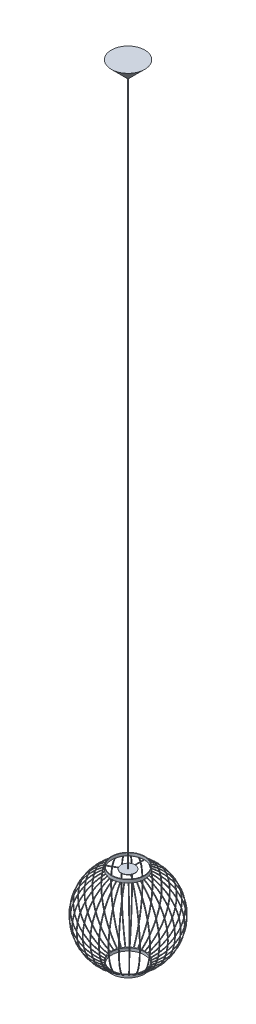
SolidWorks part; units mm, degrees
ref_plane "Alzado" through (0, 0, 0) normal (0, 0, 1) x (1, 0, 0)
ref_plane "Planta" through (0, 0, 0) normal (0, 1, 0) x (1, 0, 0)
ref_plane "Vista lateral" through (0, 0, 0) normal (1, 0, 0) x (0, 0, -1)
sketch "Croquis1" plane through (0, 0, 0) normal (0, 0, 1) x (1, 0, 0)
  line L0 (0, 0) -> (0, 2805) construction
  line L1 (-58, 0) -> (-60, 0)
  line L2 (0, 0) -> (0, 305) construction
  line L3 (0, 0) -> (0, 152.5) construction
  line L4 (0, 152.5) -> (-150, 152.5) construction
  line L5 (-58, 305.0698) -> (-60, 305)
  line L6 (-60, 0) -> (-60, 10)
  line L8 (0, 10) -> (0, 0)
  line L9 (0, 295) -> (0, 305)
  line L10 (-60, 305) -> (-60, 295)
  line L12 (0, 295) -> (0, 10)
  line L13 (-60, 305) -> (-58, 305.0698)
  line L14 (-58, 305.0698) -> (-58, 296)
  line L15 (-60, 0) -> (-59.5703, 0)
  line L16 (-58, 0) -> (-58, 10)
  line L17 (-58, 10) -> (-58, 10.1663)
  line L18 (-58, 294.8337) -> (0, 295)
  line L19 (0, 296) -> (-58, 296)
  line L20 (0, 296) -> (-1, 296)
  line L21 (0, 2805) -> (-60, 2805)
  line L22 (0, 2805) -> (0, 2745)
  line L23 (-1, 2746) -> (-60, 2805)
  line L24 (0, 305) -> (0, 2745)
  line L25 (-1, 296) -> (-1, 2746)
  arc A0 (-60, 295) -> (-60, 10) centre (7.8125, 152.5) ccw
  arc A1 (-58, 294.8337) -> (-58, 10.1663) centre (7.8125, 152.5) ccw
  dimension "D3" = 305
  dimension "D6" = 2
  dimension "D1" = 2805
  dimension "D2" = 150
  dimension "D4" = 10
  dimension "D5" = 60
  dimension "D7" = 10
  dimension "D8" = 10.2362
  dimension "D9" = 2
  dimension "D10" = 1
revolve "Revolución1" add sketch "Croquis1" angle 360 about L0
sketch "Croquis3" plane through (0, 296, 0) normal (0, 1, 0) x (1, 0, 0)
  line L0 (22.1333, -11.624) -> (50.7295, -28.134)
  line L1 (1, 24.98) -> (1, 58)
  line L2 (-1, 24.98) -> (-1, 58)
  line L3 (21.1333, -13.356) -> (49.7295, -29.866)
  line L4 (-21.1333, -13.356) -> (-49.7295, -29.866)
  line L5 (-22.1333, -11.624) -> (-50.7295, -28.134)
  arc A0 (-1, 24.98) -> (-22.1333, -11.624) centre (0, 0) ccw
  arc A1 (-1, 58) -> (-50.7295, -28.134) centre (0, 0) ccw
  arc A2 (-21.1333, -13.356) -> (21.1333, -13.356) centre (0, 0) ccw
  arc A3 (-49.7295, -29.866) -> (49.7295, -29.866) centre (0, 0) ccw
  arc A4 (22.1333, -11.624) -> (1, 24.98) centre (0, 0) ccw
  arc A5 (50.7295, -28.134) -> (1, 58) centre (0, 0) ccw
  point P16 (0, 0)
  dimension "D1" = 3
extrude "Cortar-Extruir1" cut sketch "Croquis3" against normal blind 10
sketch "Croquis5" plane through (0, 296, 0) normal (0, 1, 0) x (1, 0, 0)
  line L0 (11.6959, 58.849) -> (30.3621, 161.7084)
  line L1 (1, 59.9917) -> (1, 164.5311)
  line L2 (-1, 59.9917) -> (-1, 164.5311)
  line L3 (9.728, 59.2061) -> (28.3942, 162.0655)
  line L4 (22.0158, 55.8149) -> (58.7483, 153.6884)
  line L5 (20.1433, 56.5177) -> (56.8758, 154.3911)
  line L6 (31.6281, 50.9869) -> (85.2463, 140.7286)
  line L7 (29.9112, 52.0127) -> (83.5294, 141.7544)
  line L8 (40.2239, 44.5201) -> (109.0044, 123.2457)
  line L9 (38.7178, 45.836) -> (107.4983, 124.5616)
  line L10 (47.5269, 36.6224) -> (129.2591, 101.8016)
  line L11 (46.2799, 38.186) -> (128.0121, 103.3653)
  line L12 (53.3023, 27.5476) -> (145.3592, 77.0855)
  line L13 (52.3545, 29.3088) -> (144.4115, 78.8467)
  line L14 (57.3645, 17.5874) -> (156.7874, 49.8918)
  line L15 (56.7464, 19.4895) -> (156.1693, 51.794)
  line L16 (59.583, 7.0619) -> (163.1763, 21.0946)
  line L17 (59.3145, 9.0438) -> (162.9078, 23.0765)
  line L18 (59.8864, -3.6905) -> (164.3205, -8.3807)
  line L19 (59.9761, -1.6925) -> (164.4103, -6.3827)
  line L20 (58.265, -14.3243) -> (160.1834, -37.5865)
  line L21 (58.7101, -12.3745) -> (160.6285, -35.6367)
  line L22 (54.771, -24.4978) -> (150.8979, -65.5844)
  line L23 (55.557, -22.6587) -> (151.6839, -63.7453)
  line L24 (49.5165, -33.8838) -> (136.7623, -91.4742)
  line L25 (50.6183, -32.2147) -> (137.8641, -89.8051)
  line L26 (42.6706, -42.1808) -> (118.2312, -114.4241)
  line L27 (44.0527, -40.7352) -> (119.6133, -112.9785)
  line L28 (34.4532, -49.1221) -> (95.8999, -133.6962)
  line L29 (36.0712, -47.9465) -> (97.518, -132.5206)
  line L30 (25.1284, -54.4845) -> (70.4864, -148.6713)
  line L31 (26.9304, -53.6167) -> (72.2883, -147.8035)
  line L32 (14.996, -58.0958) -> (42.8074, -158.8679)
  line L33 (16.924, -57.5637) -> (44.7353, -158.3358)
  line L34 (4.3816, -59.8398) -> (13.7525, -163.9584)
  line L35 (6.3736, -59.6605) -> (15.7444, -163.7791)
  line L36 (-6.3736, -59.6605) -> (-15.7444, -163.7791)
  line L37 (-4.3816, -59.8398) -> (-13.7525, -163.9584)
  line L38 (-16.924, -57.5637) -> (-44.7353, -158.3358)
  line L39 (-14.996, -58.0958) -> (-42.8074, -158.8679)
  line L40 (-26.9304, -53.6167) -> (-72.2883, -147.8035)
  line L41 (-25.1284, -54.4845) -> (-70.4864, -148.6713)
  line L42 (-36.0712, -47.9465) -> (-97.518, -132.5206)
  line L43 (-34.4532, -49.1221) -> (-95.8999, -133.6962)
  line L44 (-44.0527, -40.7352) -> (-119.6133, -112.9785)
  line L45 (-42.6706, -42.1808) -> (-118.2312, -114.4241)
  line L46 (-50.6183, -32.2147) -> (-137.8641, -89.8051)
  line L47 (-49.5165, -33.8838) -> (-136.7623, -91.4742)
  line L48 (-55.557, -22.6587) -> (-151.6839, -63.7453)
  line L49 (-54.771, -24.4978) -> (-150.8979, -65.5844)
  line L50 (-58.7101, -12.3745) -> (-160.6285, -35.6367)
  line L51 (-58.265, -14.3243) -> (-160.1834, -37.5865)
  line L52 (-59.9761, -1.6925) -> (-164.4103, -6.3827)
  line L53 (-59.8864, -3.6905) -> (-164.3205, -8.3807)
  line L54 (-59.3145, 9.0438) -> (-162.9078, 23.0765)
  line L55 (-59.583, 7.0619) -> (-163.1763, 21.0946)
  line L56 (-56.7464, 19.4895) -> (-156.1693, 51.794)
  line L57 (-57.3645, 17.5874) -> (-156.7874, 49.8918)
  line L58 (-52.3545, 29.3088) -> (-144.4115, 78.8467)
  line L59 (-53.3023, 27.5476) -> (-145.3592, 77.0855)
  line L60 (-46.2799, 38.186) -> (-128.0121, 103.3653)
  line L61 (-47.5269, 36.6224) -> (-129.2591, 101.8016)
  line L62 (-38.7178, 45.836) -> (-107.4983, 124.5616)
  line L63 (-40.2239, 44.5201) -> (-109.0044, 123.2457)
  line L64 (-29.9112, 52.0127) -> (-83.5294, 141.7544)
  line L65 (-31.6281, 50.9869) -> (-85.2463, 140.7286)
  line L66 (-20.1433, 56.5177) -> (-56.8758, 154.3911)
  line L67 (-22.0158, 55.8149) -> (-58.7483, 153.6884)
  line L68 (-9.728, 59.2061) -> (-28.3942, 162.0655)
  line L69 (-11.6959, 58.849) -> (-30.3621, 161.7084)
  arc A0 (-1, 59.9917) -> (-9.728, 59.2061) centre (0, 0) ccw
  arc A1 (-1, 164.5311) -> (-28.3942, 162.0655) centre (0, 0) ccw
  arc A2 (-30.3621, 161.7084) -> (-56.8758, 154.3911) centre (0, 0) ccw
  arc A3 (-58.7483, 153.6884) -> (-83.5294, 141.7544) centre (0, 0) ccw
  arc A4 (-85.2463, 140.7286) -> (-107.4983, 124.5616) centre (0, 0) ccw
  arc A5 (-109.0044, 123.2457) -> (-128.0121, 103.3653) centre (0, 0) ccw
  arc A6 (-129.2591, 101.8016) -> (-144.4115, 78.8467) centre (0, 0) ccw
  arc A7 (-145.3592, 77.0855) -> (-156.1693, 51.794) centre (0, 0) ccw
  arc A8 (-156.7874, 49.8918) -> (-162.9078, 23.0765) centre (0, 0) ccw
  arc A9 (-163.1763, 21.0946) -> (-164.4103, -6.3827) centre (0, 0) ccw
  arc A10 (-164.3205, -8.3807) -> (-160.6285, -35.6367) centre (0, 0) ccw
  arc A11 (-160.1834, -37.5865) -> (-151.6839, -63.7453) centre (0, 0) ccw
  arc A12 (-150.8979, -65.5844) -> (-137.8641, -89.8051) centre (0, 0) ccw
  arc A13 (-136.7623, -91.4742) -> (-119.6133, -112.9785) centre (0, 0) ccw
  arc A14 (-118.2312, -114.4241) -> (-97.518, -132.5206) centre (0, 0) ccw
  arc A15 (-95.8999, -133.6962) -> (-72.2883, -147.8035) centre (0, 0) ccw
  arc A16 (-70.4864, -148.6713) -> (-44.7353, -158.3358) centre (0, 0) ccw
  arc A17 (-42.8074, -158.8679) -> (-15.7444, -163.7791) centre (0, 0) ccw
  arc A18 (-13.7525, -163.9584) -> (13.7525, -163.9584) centre (0, 0) ccw
  arc A19 (15.7444, -163.7791) -> (42.8074, -158.8679) centre (0, 0) ccw
  arc A20 (44.7353, -158.3358) -> (70.4864, -148.6713) centre (0, 0) ccw
  arc A21 (72.2883, -147.8035) -> (95.8999, -133.6962) centre (0, 0) ccw
  arc A22 (97.518, -132.5206) -> (118.2312, -114.4241) centre (0, 0) ccw
  arc A23 (137.8641, -89.8051) -> (150.8979, -65.5844) centre (0, 0) ccw
  arc A24 (119.6133, -112.9785) -> (136.7623, -91.4742) centre (0, 0) ccw
  arc A25 (151.6839, -63.7453) -> (160.1834, -37.5865) centre (0, 0) ccw
  arc A26 (160.6285, -35.6367) -> (164.3205, -8.3807) centre (0, 0) ccw
  arc A27 (164.4103, -6.3827) -> (163.1763, 21.0946) centre (0, 0) ccw
  arc A28 (162.9078, 23.0765) -> (156.7874, 49.8918) centre (0, 0) ccw
  arc A29 (156.1693, 51.794) -> (145.3592, 77.0855) centre (0, 0) ccw
  arc A30 (144.4115, 78.8467) -> (129.2591, 101.8016) centre (0, 0) ccw
  arc A31 (128.0121, 103.3653) -> (109.0044, 123.2457) centre (0, 0) ccw
  arc A32 (107.4983, 124.5616) -> (85.2463, 140.7286) centre (0, 0) ccw
  arc A33 (83.5294, 141.7544) -> (58.7483, 153.6884) centre (0, 0) ccw
  arc A34 (56.8758, 154.3911) -> (30.3621, 161.7084) centre (0, 0) ccw
  arc A35 (28.3942, 162.0655) -> (1, 164.5311) centre (0, 0) ccw
  arc A36 (-11.6959, 58.849) -> (-20.1433, 56.5177) centre (0, 0) ccw
  arc A37 (-22.0158, 55.8149) -> (-29.9112, 52.0127) centre (0, 0) ccw
  arc A38 (-31.6281, 50.9869) -> (-38.7178, 45.836) centre (0, 0) ccw
  arc A39 (-40.2239, 44.5201) -> (-46.2799, 38.186) centre (0, 0) ccw
  arc A40 (-47.5269, 36.6224) -> (-52.3545, 29.3088) centre (0, 0) ccw
  arc A41 (-53.3023, 27.5476) -> (-56.7464, 19.4895) centre (0, 0) ccw
  arc A42 (-57.3645, 17.5874) -> (-59.3145, 9.0438) centre (0, 0) ccw
  arc A43 (-59.583, 7.0619) -> (-59.9761, -1.6925) centre (0, 0) ccw
  arc A44 (-59.8864, -3.6905) -> (-58.7101, -12.3745) centre (0, 0) ccw
  arc A45 (-58.265, -14.3243) -> (-55.557, -22.6587) centre (0, 0) ccw
  arc A46 (-54.771, -24.4978) -> (-50.6183, -32.2147) centre (0, 0) ccw
  arc A47 (-49.5165, -33.8838) -> (-44.0527, -40.7352) centre (0, 0) ccw
  arc A48 (-42.6706, -42.1808) -> (-36.0712, -47.9465) centre (0, 0) ccw
  arc A49 (-34.4532, -49.1221) -> (-26.9304, -53.6167) centre (0, 0) ccw
  arc A50 (-25.1284, -54.4845) -> (-16.924, -57.5637) centre (0, 0) ccw
  arc A51 (-14.996, -58.0958) -> (-6.3736, -59.6605) centre (0, 0) ccw
  arc A52 (-4.3816, -59.8398) -> (4.3816, -59.8398) centre (0, 0) ccw
  arc A53 (6.3736, -59.6605) -> (14.996, -58.0958) centre (0, 0) ccw
  arc A54 (16.924, -57.5637) -> (25.1284, -54.4845) centre (0, 0) ccw
  arc A55 (26.9304, -53.6167) -> (34.4532, -49.1221) centre (0, 0) ccw
  arc A56 (36.0712, -47.9465) -> (42.6706, -42.1808) centre (0, 0) ccw
  arc A57 (44.0527, -40.7352) -> (49.5165, -33.8838) centre (0, 0) ccw
  arc A58 (50.6183, -32.2147) -> (54.771, -24.4978) centre (0, 0) ccw
  arc A59 (55.557, -22.6587) -> (58.265, -14.3243) centre (0, 0) ccw
  arc A60 (58.7101, -12.3745) -> (59.8864, -3.6905) centre (0, 0) ccw
  arc A61 (59.9761, -1.6925) -> (59.583, 7.0619) centre (0, 0) ccw
  arc A62 (59.3145, 9.0438) -> (57.3645, 17.5874) centre (0, 0) ccw
  arc A63 (56.7464, 19.4895) -> (53.3023, 27.5476) centre (0, 0) ccw
  arc A64 (52.3545, 29.3088) -> (47.5269, 36.6224) centre (0, 0) ccw
  arc A65 (46.2799, 38.186) -> (40.2239, 44.5201) centre (0, 0) ccw
  arc A66 (38.7178, 45.836) -> (31.6281, 50.9869) centre (0, 0) ccw
  arc A67 (29.9112, 52.0127) -> (22.0158, 55.8149) centre (0, 0) ccw
  arc A68 (20.1433, 56.5177) -> (11.6959, 58.849) centre (0, 0) ccw
  arc A69 (9.728, 59.2061) -> (1, 59.9917) centre (0, 0) ccw
  point P144 (0, 0)
  dimension "D1" = 35
extrude "Cortar-Extruir2" cut sketch "Croquis5" against normal through all
